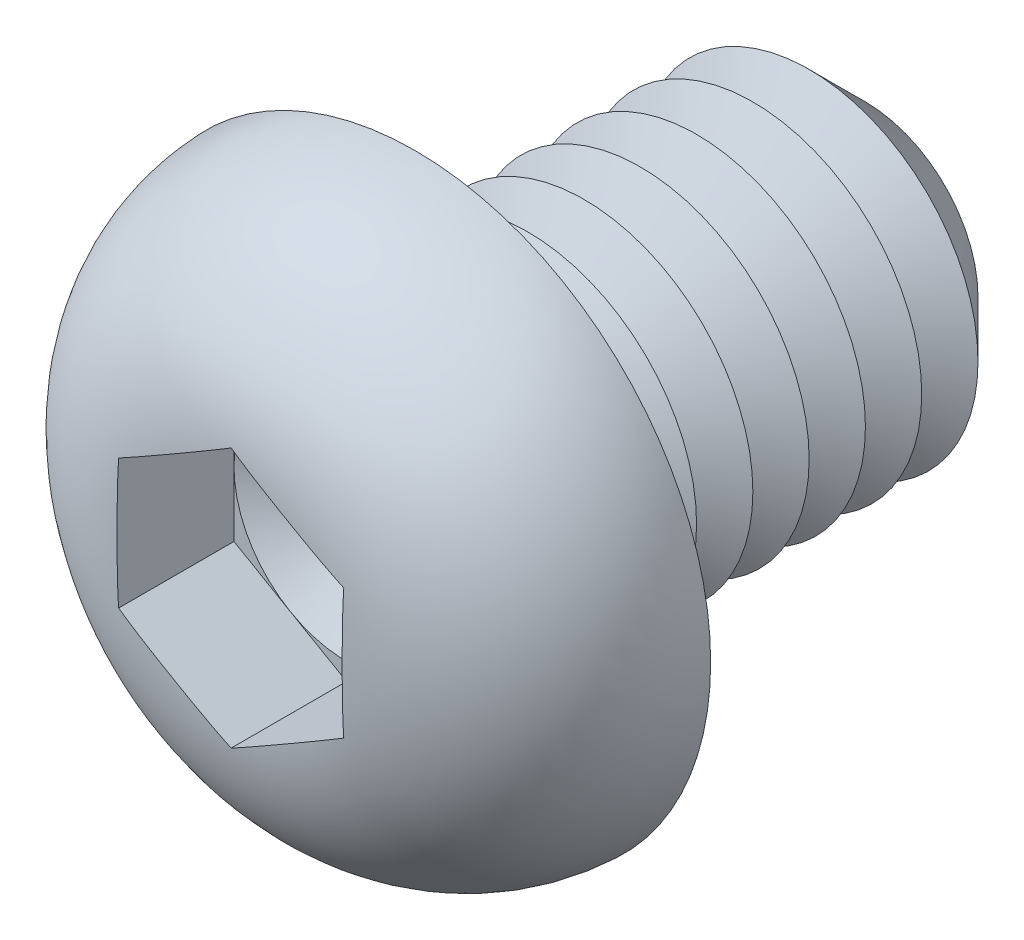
SolidWorks part; units mm, degrees
ref_plane "Front Plane" through (0, 0, 0) normal (0, 0, 1) x (1, 0, 0)
ref_plane "Top Plane" through (0, 0, 0) normal (0, 1, 0) x (1, 0, 0)
ref_plane "Right Plane" through (0, 0, 0) normal (1, 0, 0) x (0, 0, -1)
sketch "Sketch1" plane through (0, 0, 0) normal (1, 0, 0) x (0, 0, -1)
  line L0 (-47.9342, 0) -> (60.3146, 0) construction
sketch "Sketch2" plane through (0, 0, 0) normal (1, 0, 0) x (0, 0, -1)
  line L0 (0, 0) -> (-3.3, 0)
  line L1 (-47.9342, 0) -> (60.3146, 0) construction
  line L2 (-3.3, 0) -> (-3.3, 1.8515)
  line L3 (0, 5.25) -> (0, 0)
  arc A0 (-3.3, 1.8515) -> (0, 5.25) centre (0.1, 1.8515) cw
  dimension "D1" = 3.4
  dimension "D2" = 3.3
  dimension "D3" = 5.25
revolve "Revolve1" add sketch "Sketch2" angle 360 about L0
sketch "Sketch3" plane through (0, 0, 3.3) normal (0, 0, 1) x (1, 0, 0)
  line L1 (0, 2.3094) -> (-2, 1.1547)
  line L2 (-2, 1.1547) -> (-2, -1.1547)
  line L3 (-2, -1.1547) -> (0, -2.3094)
  line L4 (0, -2.3094) -> (2, -1.1547)
  line L5 (2, -1.1547) -> (2, 1.1547)
  line L6 (2, 1.1547) -> (0, 2.3094)
  circle A0 centre (0, 0) radius 2 construction
  dimension "D1" = 4
extrude "Cut-Extrude1" cut sketch "Sketch3" against normal blind 2.08
sketch "Sketch4" plane through (0, 0, 0) normal (0, 0, -1) x (-1, 0, 0)
  circle A0 centre (0, 0) radius 3
  dimension "D1" = 6
extrude "Boss-Extrude1" add sketch "Sketch4" along normal blind 8
chamfer "Chamfer1" distance 1 angle 45 1 edges at (-3, 0, -8)
sketch "Sketch5" plane through (0, 0, 0) normal (1, 0, 0) x (0, 0, -1)
  line L0 (1, 3) -> (2, 3)
  line L1 (7, 3) -> (0, 3) construction
  line L2 (2, 3) -> (1.5, 2.134)
  line L3 (1.5, 2.134) -> (1, 3)
  line L4 (0, -5.25) -> (0, 5.25) construction
  line L5 (7, 3) -> (0, 3) construction
  dimension "D1" = 1
  dimension "D2" = 1
revolve "Cut-Revolve1" cut sketch "Sketch5" angle 360 about L0
pattern_linear "LPattern1" count 6 spacing 1 along (0, 0, -1) of "Cut-Revolve1"
fillet "Fillet2" radius 0.5 1 edges at (-3, 0, 0)
sketch "Sketch6" plane through (0, 0, 1.22) normal (0, 0, 1) x (1, 0, 0)
  line L0 (0, -2.3094) -> (2, -1.1547) construction
  circle A0 centre (0, 0) radius 2
extrude "Cut-Extrude2" cut sketch "Sketch6" against normal through all draft 60
